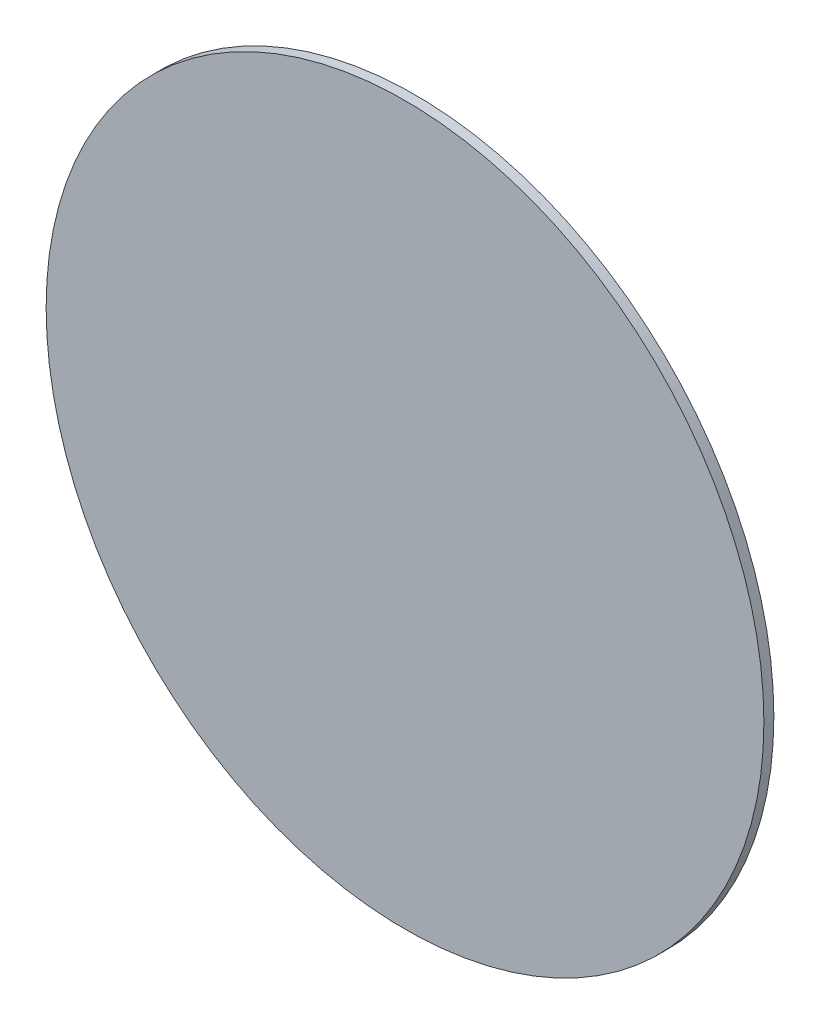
SolidWorks part; units mm, degrees
ref_plane "Front Plane" through (0, 0, 0) normal (0, 0, 1) x (1, 0, 0)
ref_plane "Top Plane" through (0, 0, 0) normal (0, 1, 0) x (1, 0, 0)
ref_plane "Right Plane" through (0, 0, 0) normal (1, 0, 0) x (0, 0, -1)
sketch "Sketch3" plane through (0, 0, 0) normal (0, 0, 1) x (1, 0, 0)
  circle A0 centre (0, 39.1553) radius 90
  dimension "D1" = 180
extrude "Boss-Extrude1" add sketch "Sketch3" along normal blind 2.5
